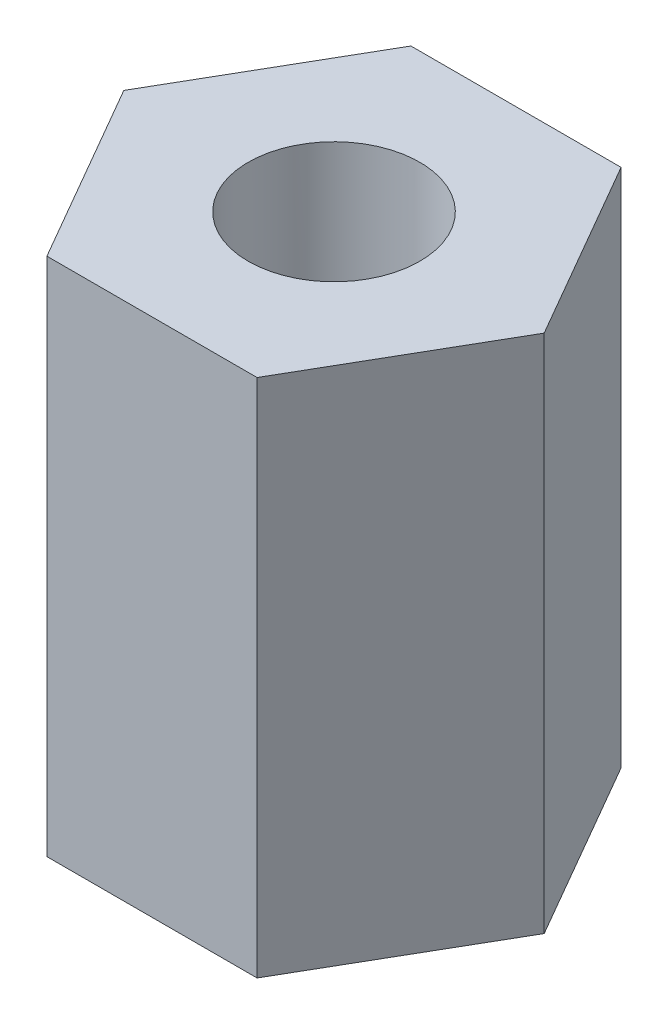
SolidWorks part; units mm, degrees
ref_plane "Aufriss" through (0, 0, 0) normal (0, 0, 1) x (1, 0, 0)
ref_plane "Grundriss" through (0, 0, 0) normal (0, 1, 0) x (1, 0, 0)
ref_plane "Seitenriss" through (0, 0, 0) normal (1, 0, 0) x (0, 0, -1)
sketch "Skizze1" plane through (0, 0, 0) normal (0, 1, 0) x (1, 0, 0)
  line L1 (2.0207, 3.5) -> (-2.0207, 3.5)
  line L2 (-2.0207, 3.5) -> (-4.0415, 0)
  line L3 (-4.0415, 0) -> (-2.0207, -3.5)
  line L4 (-2.0207, -3.5) -> (2.0207, -3.5)
  line L5 (2.0207, -3.5) -> (4.0415, 0)
  line L6 (4.0415, 0) -> (2.0207, 3.5)
  circle A0 centre (0, 0) radius 3.5 construction
  dimension "D1" = 7
extrude "Aufsatz-Linear austragen1" add sketch "Skizze1" along normal blind 10
sketch "Skizze6" plane through (0, 10, 0) normal (0, 1, 0) x (1, 0, 0)
  circle A0 centre (0, 0) radius 1.65
  dimension "D1" = 3.3
extrude "Schnitt-Linear austragen1" cut sketch "Skizze6" against normal blind 5
sketch "Skizze7" plane through (0, 0, 0) normal (0, -1, 0) x (1, 0, 0)
  circle A0 centre (0, 0) radius 1.65
  dimension "D1" = 3.3
extrude "Schnitt-Linear austragen2" cut sketch "Skizze7" against normal blind 10
